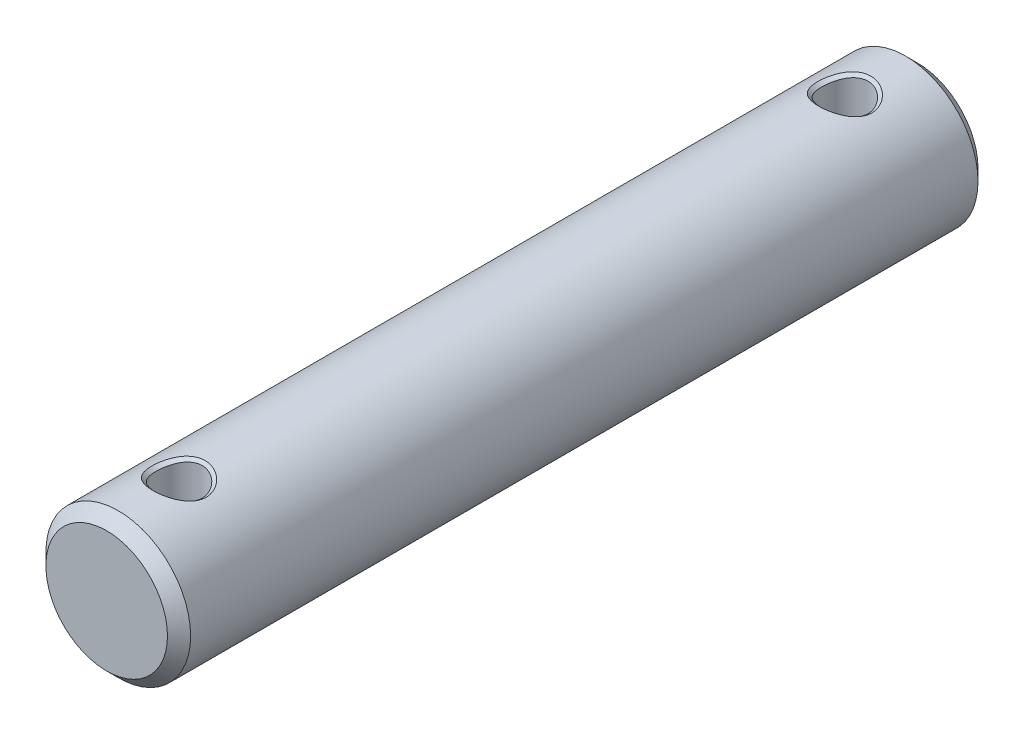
SolidWorks part; units mm, degrees
ref_plane "Plan de face" through (0, 0, 0) normal (0, 0, 1) x (1, 0, 0)
ref_plane "Plan de dessus" through (0, 0, 0) normal (0, 1, 0) x (1, 0, 0)
ref_plane "Plan de droite" through (0, 0, 0) normal (1, 0, 0) x (0, 0, -1)
sketch "Esquisse1" plane through (0, 0, 0) normal (0, 0, 1) x (1, 0, 0)
  circle A0 centre (0, 0) radius 12.5
  dimension "D1" = 25
extrude "Extrusion1" add sketch "Esquisse1" along normal blind 140
chamfer "Chanfrein1" distance 2 angle 45 2 edges at (12.5, 0, 0) (12.5, 0, 140)
sketch "Esquisse2" plane through (0, 0, 0) normal (0, 1, 0) x (1, 0, 0)
  line L0 (10.5, 0) -> (-10.5, 0) construction
  line L1 (-10.5, -140) -> (10.5, -140) construction
  circle A0 centre (0, -12.5) radius 4
  circle A1 centre (0, -127.5) radius 4
  dimension "D1" = 8
  dimension "D4" = 8
  dimension "D2" = 12.5
  dimension "D3" = 12.5
extrude "Enlèv. mat.-Extru.1" cut sketch "Esquisse2" against normal mid plane 30
chamfer "Chanfrein2" distance 0.5 angle 45 4 edges at (0.6979, 12.4805, 8.5613) (-0.6979, -12.4805, 8.5613) (0.6979, 12.4805, 123.5613) (-0.6979, -12.4805, 123.5613)
